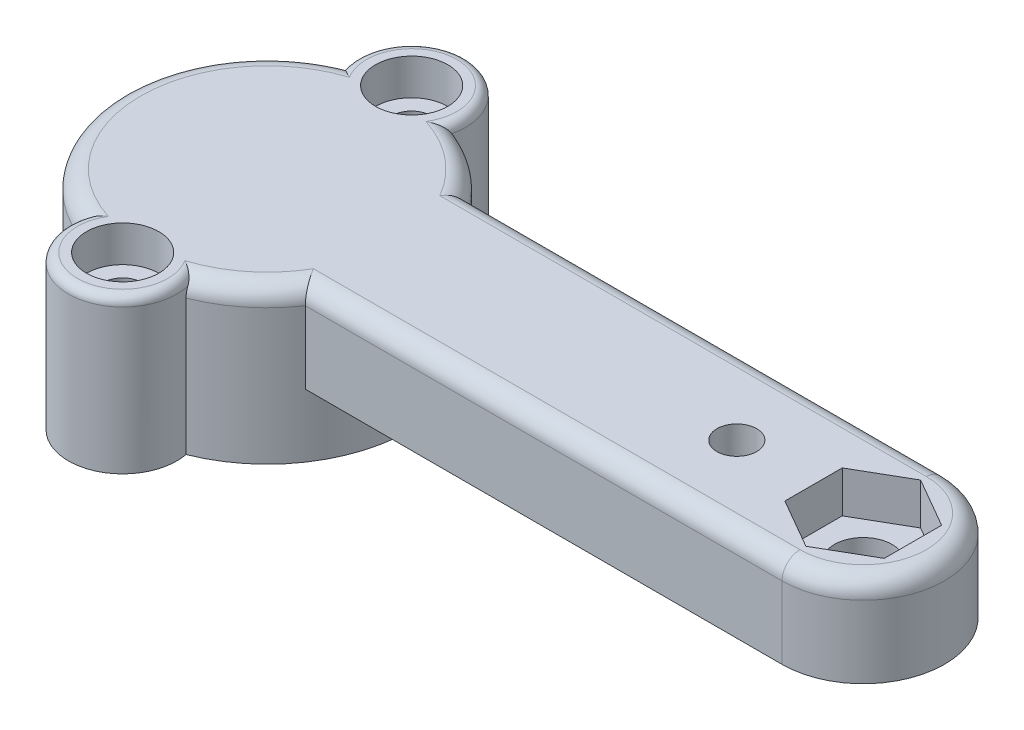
SolidWorks part; units mm, degrees
ref_plane "Plan de face" through (0, 0, 0) normal (0, 0, 1) x (1, 0, 0)
ref_plane "Plan de dessus" through (0, 0, 0) normal (0, 1, 0) x (1, 0, 0)
ref_plane "Plan de droite" through (0, 0, 0) normal (1, 0, 0) x (0, 0, -1)
sketch "Esquisse1" plane through (0, 0, 0) normal (0, 1, 0) x (1, 0, 0)
  line L0 (-40.1999, 39) -> (-66.5855, 39)
  line L1 (-40.1999, 30) -> (-66.5855, 30)
  line L4 (-40.1999, 42.0658) -> (-40.1999, 16.2463) construction
  line L5 (-73.1999, 16.2463) -> (-73.1999, 42.0658) construction
  line L6 (-35.6999, 29.0414) -> (-35.6999, 45.9292) construction
  line L7 (-47.1999, 29.0414) -> (-47.1999, 45.9292) construction
  line L9 (-79.4994, 34.5) -> (-44.5393, 34.5) construction
  line L10 (-73.1999, 24.2483) -> (-71.2499, 25.3742) construction
  line L11 (-71.2499, 25.3742) -> (-71.2499, 27.6258) construction
  line L12 (-71.2499, 27.6258) -> (-73.1999, 28.7517) construction
  line L13 (-73.1999, 28.7517) -> (-75.1499, 27.6258) construction
  line L14 (-75.1499, 27.6258) -> (-75.1499, 25.3742) construction
  line L15 (-75.1499, 25.3742) -> (-73.1999, 24.2483) construction
  arc A0 (-66.5855, 39) -> (-70.2531, 41.9375) centre (-73.1999, 34.5) ccw
  circle A1 centre (-40.1999, 34.5) radius 1.6
  arc A2 (-40.1999, 30) -> (-40.1999, 39) centre (-40.1999, 34.5) ccw
  circle A3 centre (-47.1999, 34.5) radius 1.1
  circle A4 centre (-73.1999, 34.5) radius 5 construction
  circle A5 centre (-73.1999, 26.5) radius 1.1
  arc A6 (-76.1467, 27.0625) -> (-70.2531, 27.0625) centre (-73.1999, 26.5) ccw
  circle A7 centre (-73.1999, 26.5) radius 1.95 construction
  arc A8 (-76.1467, 41.9375) -> (-70.2531, 41.9375) centre (-73.1999, 42.5) cw
  circle A9 centre (-73.1999, 42.5) radius 1.1
  arc A11 (-76.1467, 41.9375) -> (-76.1467, 27.0625) centre (-73.1999, 34.5) ccw
  arc A12 (-70.2531, 27.0625) -> (-66.5855, 30) centre (-73.1999, 34.5) ccw
  dimension "D3" = 11.5
  dimension "D1" = 33
  dimension "D2" = 4.5
extrude "Boss.-Extru.1" add sketch "Esquisse1" along normal blind 5
sketch "Esquisse2" plane through (0, 5, 0) normal (0, 1, 0) x (1, 0, 0)
  line L2 (-40.1999, 31.3246) -> (-37.4499, 32.9123)
  line L3 (-37.4499, 32.9123) -> (-37.4499, 36.0877)
  line L10 (-37.4499, 36.0877) -> (-40.1999, 37.6754)
  line L11 (-40.1999, 37.6754) -> (-42.9499, 36.0877)
  line L12 (-42.9499, 36.0877) -> (-42.9499, 32.9123)
  line L13 (-42.9499, 32.9123) -> (-40.1999, 31.3246)
  circle A1 centre (-40.1999, 34.5) radius 2.8 construction
extrude "Enlèv. mat.-Extru.1" cut sketch "Esquisse2" against normal blind 2.3
sketch "Esquisse15" plane through (0, 0, 0) normal (0, -1, 0) x (1, 0, 0)
  circle A1 centre (-73.1999, -26.5) radius 1.1
  arc A2 (-70.2531, -27.0625) -> (-76.1467, -27.0625) centre (-73.1999, -26.5) ccw
  circle A3 centre (-73.1999, -42.5) radius 1.1
  arc A4 (-76.1467, -41.9375) -> (-70.2531, -41.9375) centre (-73.1999, -42.5) ccw
  arc A5 (-76.1467, -27.0625) -> (-76.1467, -41.9375) centre (-73.1999, -34.5) ccw
  arc A6 (-70.2531, -41.9375) -> (-70.2531, -27.0625) centre (-73.1999, -34.5) ccw
extrude "Boss.-Extru.7" add sketch "Esquisse15" along normal blind 6.5
ref_plane "Plan1" through (0, 0, -34.5) normal (0, 0, 1) x (1, 0, 0)
sketch "Esquisse14" plane through (0, 0, -34.5) normal (0, 0, 1) x (1, 0, 0)
  line L0 (-73.1999, 11.2226) -> (-73.1999, -13.2246) construction
  line L1 (-67.9999, -13.2246) -> (-67.9999, 7.5813) construction
  line L2 (-87.2042, -8.5) -> (-60.2978, -8.5) construction
  line L3 (-87.2042, 0) -> (-60.2978, 0) construction
  line L4 (-40.1999, 0) -> (-66.5855, 0) construction
  line L5 (-83.5014, -3.5) -> (-60.2978, -3.5) construction
  line L6 (-73.1999, 1.7) -> (-73.1999, -8.7)
  line L7 (-73.1999, 1.7) -> (-70.9999, 1.7)
  line L8 (-81.1999, 5) -> (-81.1999, -13.2246) construction
  line L9 (-67.9999, -1.3) -> (-67.9999, -8.7)
  line L10 (-67.9999, -8.7) -> (-73.1999, -8.7)
  arc A0 (-70.9999, 1.7) -> (-67.9999, -1.3) centre (-70.9999, -1.3) cw
  circle A1 centre (-73.1999, -3.5) radius 5 construction
  point P22 (-67.9999, 1.7)
  dimension "D2" = 5
  dimension "D3" = 8
  dimension "D4" = 5.2
  dimension "D5" = 3
  dimension "D1" = 8.5
revolve "Enlèvement de matière-Révolution4" cut sketch "Esquisse14" angle 360 about L0
sketch "Esquisse19" plane through (0, 0, 0) normal (0, -1, 0) x (1, 0, 0)
  circle A0 centre (-47.1999, -34.5) radius 2.2
extrude "Enlèv. mat.-Extru.8" cut sketch "Esquisse19" against normal blind 2
sketch "Esquisse20" plane through (0, 5, 0) normal (0, 1, 0) x (1, 0, 0)
  circle A0 centre (-73.1999, 26.5) radius 2
  circle A1 centre (-73.1999, 42.5) radius 2
extrude "Enlèv. mat.-Extru.9" cut sketch "Esquisse20" against normal blind 2
sketch "Esquisse21" plane through (0, -6.5, 0) normal (0, -1, 0) x (1, 0, 0)
  line L1 (-71.0059, -26.5) -> (-72.1029, -24.6)
  line L2 (-72.1029, -24.6) -> (-74.2968, -24.6)
  line L3 (-74.2968, -24.6) -> (-75.3938, -26.5)
  line L4 (-75.3938, -26.5) -> (-74.2968, -28.4)
  line L5 (-74.2968, -28.4) -> (-72.1029, -28.4)
  line L6 (-72.1029, -28.4) -> (-71.0059, -26.5)
  line L7 (-71.0059, -42.5) -> (-72.1029, -40.6)
  line L8 (-72.1029, -40.6) -> (-74.2968, -40.6)
  line L9 (-74.2968, -40.6) -> (-75.3938, -42.5)
  line L10 (-75.3938, -42.5) -> (-74.2968, -44.4)
  line L11 (-74.2968, -44.4) -> (-72.1029, -44.4)
  line L12 (-72.1029, -44.4) -> (-71.0059, -42.5)
  circle A0 centre (-73.1999, -26.5) radius 1.9 construction
  circle A1 centre (-73.1999, -42.5) radius 1.9 construction
extrude "Enlèv. mat.-Extru.10" cut sketch "Esquisse21" against normal blind 1.6
sketch "Esquisse22" plane through (0, 0, 0) normal (0, 0, 1) x (1, 0, 0)
  line L0 (-60.346, -6.5) -> (-82.5752, -6.5) construction
  line L1 (-60.346, -3.5) -> (-82.5752, -3.5) construction
  line L3 (-81.8473, -3.5) -> (-63.3696, -3.5)
  line L4 (-81.8473, -3.5) -> (-81.8473, -6.5)
  line L5 (-81.8473, -6.5) -> (-63.3696, -6.5)
  line L6 (-63.3696, -3.5) -> (-63.3696, -6.5)
  dimension "D1" = 3
extrude "Enlèv. mat.-Extru.11" cut sketch "Esquisse22" against normal through all
fillet "Congé1" radius 1 6 edges at (-53.3927, 5, -39) (-35.6999, 5, -34.5) (-53.3927, 5, -30) (-68.1987, 5, -28.2559) (-68.1987, 5, -40.7441) (-81.1999, 5, -34.5)
fillet "Congé2" radius 0.5 2 edges at (-73.1999, 5, -23.5) (-73.1999, 5, -45.5)
